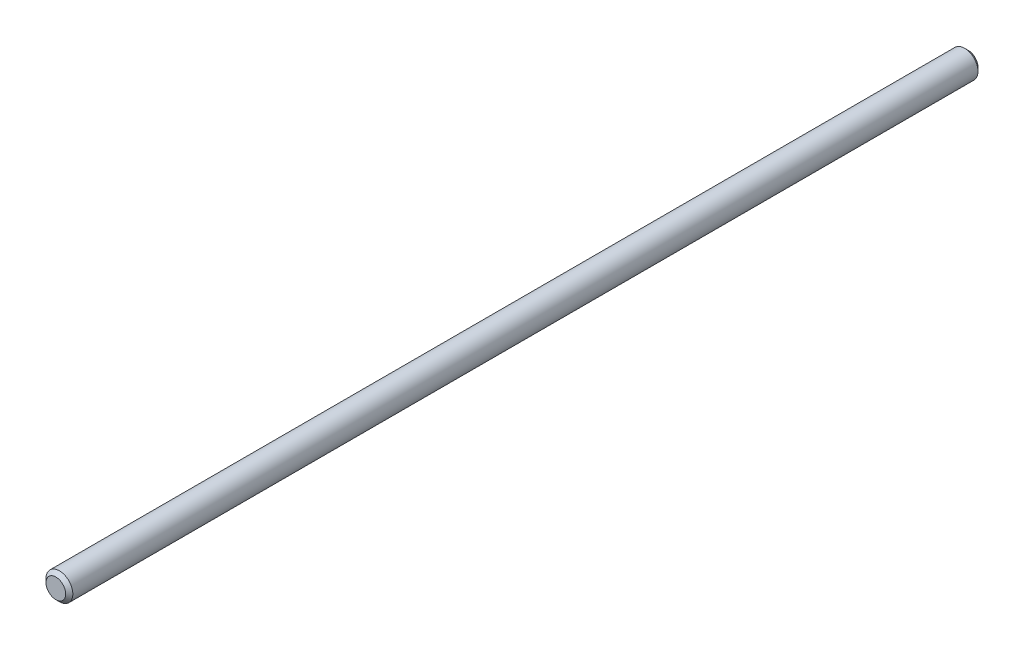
SolidWorks part; units mm, degrees
ref_plane "Plan de face" through (0, 0, 0) normal (0, 0, 1) x (1, 0, 0)
ref_plane "Plan de dessus" through (0, 0, 0) normal (0, 1, 0) x (1, 0, 0)
ref_plane "Plan de droite" through (0, 0, 0) normal (1, 0, 0) x (0, 0, -1)
sketch "Esquisse1" plane through (0, 0, 0) normal (0, 0, 1) x (1, 0, 0)
  circle A0 centre (0, 0) radius 0.75
  dimension "D1" = 1.5
extrude "Extrusion1" add sketch "Esquisse1" along normal blind 51
chamfer "Chanfrein1" distance 0.2 angle 45 2 edges at (0.75, 0, 0) (0.75, 0, 51)
